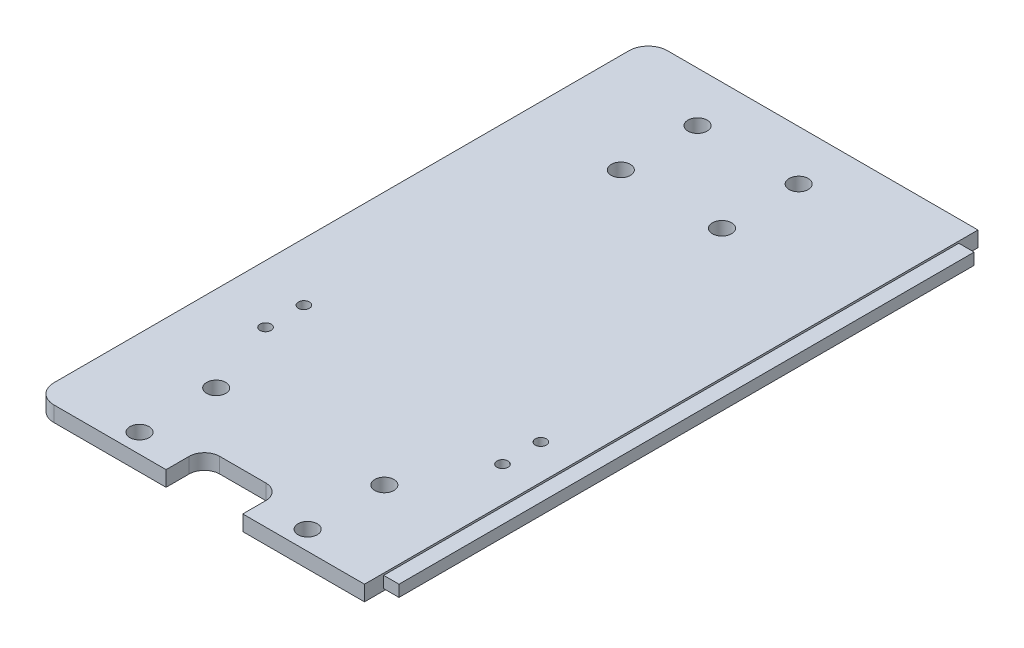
SolidWorks part; units mm, degrees
other "Markup1"
sketch "Sketch18" plane through (-127, 2.54, 10.16) normal (0, 1, 0) x (1, 0, 0)
sketch "Sketch20" plane through (-127, 2.54, 10.16) normal (0, 1, 0) x (1, 0, 0)
sketch "Sketch21" plane through (-127, 2.54, 10.16) normal (0, 1, 0) x (1, 0, 0)
sketch "Sketch22" plane through (-127, 2.54, 10.16) normal (0, 1, 0) x (1, 0, 0)
sketch "Sketch23" plane through (-127, 2.54, 10.16) normal (0, 1, 0) x (1, 0, 0)
sketch "Sketch24" plane through (-127, 2.54, 10.16) normal (0, 1, 0) x (1, 0, 0)
sketch "Sketch25" plane through (-127, 2.54, 10.16) normal (0, 1, 0) x (1, 0, 0)
sketch "Sketch27" plane through (-127, 2.54, 0) normal (0, 1, 0) x (1, 0, 0)
sketch "Sketch29" plane through (-127, 2.54, 0) normal (0, 1, 0) x (1, 0, 0)
sketch "Sketch30" plane through (-127, 2.54, 0) normal (0, 1, 0) x (1, 0, 0)
sketch "Sketch46" plane through (0, 12.7, -5.842) normal (0, 1, 0) x (1, 0, 0)
sketch "Sketch49" plane through (0, 2.54, 0) normal (0, 1, 0) x (1, 0, 0)
ref_plane "Front Plane" through (0, 0, 0) normal (0, 0, 1) x (1, 0, 0)
ref_plane "Top Plane" through (0, 0, 0) normal (0, 1, 0) x (1, 0, 0)
ref_plane "Right Plane" through (0, 0, 0) normal (1, 0, 0) x (0, 0, -1)
sketch "Sketch1" plane through (0, 0, 0) normal (0, 0, 1) x (1, 0, 0)
  line L6 (127, 2.54) -> (-127, 2.54)
  line L24 (127, 2.54) -> (127, -2.54)
  line L25 (127, -2.54) -> (-127, -2.54)
  line L26 (-127, 2.54) -> (-127, -2.54)
  line L27 (127, 2.54) -> (-127, -2.54) construction
  line L28 (127, -2.54) -> (-127, 2.54) construction
  point P0 (0, 0)
  point P1 (0, 0)
  dimension "D1" = 5.08
  dimension "D2" = 254
extrude "Boss-Extrude1" add sketch "Sketch1" along normal blind 203.2
sketch "Sketch2" plane through (0, 2.54, 0) normal (0, 1, 0) x (1, 0, 0)
  line L0 (127, -203.2) -> (-127, -203.2) construction
  line L1 (-127, 0) -> (-101.6, 0)
  line L2 (-127, 0) -> (-127, -203.2)
  line L3 (-127, -203.2) -> (-101.6, -203.2)
  line L4 (-101.6, 0) -> (-101.6, -203.2)
  line L6 (127, 0) -> (101.6, 0)
  line L7 (127, 0) -> (127, -203.2)
  line L8 (127, -203.2) -> (101.6, -203.2)
  line L9 (101.6, 0) -> (101.6, -203.2)
  dimension "D1" = 25.4
sketch "Sketch3" plane through (0, 2.54, 0) normal (0, 1, 0) x (1, 0, 0)
  line L1 (-127, -22.86) -> (-101.6, -22.86) construction
  line L2 (-127, 0) -> (-127, -203.2) construction
  line L3 (-101.6, 0) -> (-101.6, -203.2) construction
  line L4 (-114.3, -22.86) -> (-114.3, -180.34) construction
  line L5 (0, 0) -> (0, -203.2) construction
  line L6 (127, 0) -> (-127, 0) construction
  line L7 (127, -203.2) -> (-127, -203.2) construction
  line L8 (-127, 0) -> (-101.6, 0) construction
  line L9 (101.6, -21.6084) -> (127, -21.6084) construction
  line L10 (101.6, 0) -> (101.6, -203.2) construction
  line L11 (127, 0) -> (127, -203.2) construction
  circle A0 centre (-114.3, -22.86) radius 2.1
  circle A1 centre (-114.3, -180.34) radius 2.1
  circle A2 centre (114.3, -22.86) radius 2.1
  circle A3 centre (114.3, -180.34) radius 2.1
  point P14 (-114.3, -22.86)
  point P21 (-114.3, -101.6)
  point P22 (0, -101.6)
  point P26 (114.3, -21.6084)
  dimension "D1" = 4.2
  dimension "D2" = 22.86
extrude "Cut-Extrude1" [suppressed] cut sketch "Sketch3" against normal through all
sketch "Sketch5" plane through (0, 2.54, 0) normal (0, 1, 0) x (1, 0, 0)
  circle A2 centre (97.63, -133.2) radius 1.8288
  circle A3 centre (97.63, -133.2) radius 1.8288
  circle A4 centre (97.63, -145.9) radius 1.8288
  circle A5 centre (97.63, -145.9) radius 1.8288
  circle A6 centre (-19.21, -133.2) radius 1.8288
  circle A7 centre (-19.21, -133.2) radius 1.8288
  circle A8 centre (-19.21, -145.9) radius 1.8288
  circle A9 centre (-19.21, -145.9) radius 1.8288
  circle A13 centre (-97.696, -133.2) radius 1.8288
  circle A14 centre (-97.696, -145.9) radius 1.8288
  circle A15 centre (19.144, -133.2) radius 1.8288
  circle A16 centre (19.144, -145.9) radius 1.8288
  dimension "D5" = 78.486
  dimension "D6" = 78.486
  dimension "D1" = 0
  dimension "D2" = 0
  dimension "D3" = 0
  dimension "D4" = 0
extrude "Cut-Extrude2" cut sketch "Sketch5" against normal blind 152.4
sketch "Sketch7" [suppressed] plane through (0, -2.54, 0) normal (0, -1, 0) x (1, 0, 0)
  line L1 (-127, 203.2) -> (-101.6, 203.2)
  line L2 (-127, 203.2) -> (-127, 0)
  line L3 (-127, 0) -> (-101.6, 0)
  line L4 (-101.6, 203.2) -> (-101.6, 0)
  line L5 (127, 203.2) -> (101.6, 203.2)
  line L6 (127, 203.2) -> (127, 0)
  line L7 (127, 0) -> (101.6, 0)
  line L8 (101.6, 203.2) -> (101.6, 0)
  circle A0 centre (-114.3, 180.34) radius 6.35
  circle A1 centre (-114.3, 22.86) radius 6.35
  circle A2 centre (114.3, 22.86) radius 6.35
  circle A3 centre (114.3, 180.34) radius 6.35
  dimension "D1" = 12.7
extrude "Boss-Extrude2" [suppressed] add sketch "Sketch7" along normal blind 7.62
sketch "Sketch8" [suppressed] plane through (0, 2.54, 0) normal (0, 1, 0) x (1, 0, 0)
  circle A0 centre (-89.6874, -180.34) radius 3.175
  circle A1 centre (-89.6874, -154.94) radius 3.175
  point P3 (-114.3, -180.34)
  dimension "D1" = 6.35
  dimension "D2" = 24.6126
  dimension "D3" = 25.4
sketch "Sketch9" plane through (0, 2.54, 0) normal (0, 1, 0) x (1, 0, 0)
  line L0 (127, 0) -> (-127, 0) construction
  line L1 (-91.63, 0) -> (-83.63, 0)
  line L2 (-91.63, 0) -> (-91.63, -12.7)
  line L3 (-91.63, -12.7) -> (-83.63, -12.7)
  line L4 (-83.63, 0) -> (-83.63, -12.7)
  line L5 (-87.63, 0) -> (-87.63, -55.7623) construction
  line L6 (-127, -203.2) -> (-127, 0) construction
  line L7 (-61.405, -25.4) -> (-61.405, -12.7) construction
  circle A0 centre (-61.405, -12.7) radius 3.175
  circle A1 centre (-61.405, -25.4) radius 3.175
  dimension "D1" = 6.35
  dimension "D2" = 6.35
  dimension "D3" = 39.37
  dimension "D4" = 12.7
  dimension "D5" = 12.7
  dimension "D6" = 8
  dimension "D7" = 22.225
  dimension "D8" = 4
  dimension "D9" = 12.7
sketch "Sketch12" plane through (0, 2.54, 0) normal (0, 1, 0) x (1, 0, 0)
  line L0 (-91.7385, -29.21) -> (-40.9385, -29.21) construction
  line L1 (-127, -203.2) -> (-127, 0) construction
  line L2 (-66.3384, -41.91) -> (-66.3384, -16.51) construction
  line L4 (127, 0) -> (-127, 0) construction
  circle A0 centre (-91.7385, -29.21) radius 3.175
  circle A1 centre (-40.9385, -29.21) radius 3.175
  circle A2 centre (-66.3384, -16.51) radius 3.175
  circle A3 centre (-66.3384, -41.91) radius 3.175
  point P8 (-66.3385, -29.21)
  point P11 (-66.3385, -29.21)
  dimension "D1" = 6.35
  dimension "D2" = 50.8
  dimension "D3" = 29.21
  dimension "D4" = 25.4
  dimension "D5" = 60.6615
extrude "Cut-Extrude7" cut sketch "Sketch12" against normal through all
sketch "Sketch14" plane through (0, 2.54, 0) normal (0, 1, 0) x (1, 0, 0)
  line L0 (127, 0) -> (-127, 0) construction
  line L1 (-127, -203.2) -> (-127, 0) construction
  circle A0 centre (-32.8328, -16.51) radius 3.175
  circle A1 centre (-32.8328, -41.91) radius 3.175
  dimension "D1" = 6.35
  dimension "D4" = 94.1672
  dimension "D2" = 25.4
  dimension "D3" = 16.51
extrude "Cut-Extrude8" cut sketch "Sketch14" against normal up to next
mirror "Mirror1" about plane through (0, 0, 0) normal (1, 0, 0) of "Cut-Extrude8", "Cut-Extrude7"
sketch "Sketch15" plane through (0, 2.54, 0) normal (0, 1, 0) x (1, 0, 0)
  line L0 (127, -203.2) -> (127, 0) construction
  line L1 (-127, 0) -> (127, 0)
  line L2 (-127, 0) -> (-127, -10.16)
  line L3 (-127, -10.16) -> (127, -10.16)
  line L4 (127, 0) -> (127, -10.16)
  dimension "D1" = 10.16
extrude "Cut-Extrude9" [suppressed] cut sketch "Sketch15" against normal up to next
sketch "Sketch16" plane through (0, 2.54, 0) normal (0, 1, 0) x (1, 0, 0)
  line L0 (127, -203.2) -> (127, 0) construction
  line L1 (127, -203.2) -> (-127, -203.2) construction
  circle A0 centre (84.0486, -196.85) radius 3.175
  circle A1 centre (84.0486, -171.45) radius 3.175
  dimension "D2" = 6.35
  dimension "D1" = 42.9514
  dimension "D3" = 25.4
  dimension "D4" = 6.35
extrude "Cut-Extrude10" cut sketch "Sketch16" against normal through all
mirror "Mirror2" about plane through (0, 0, 0) normal (1, 0, 0) of "Cut-Extrude10"
sketch "Sketch17" plane through (0, 2.54, 0) normal (0, 1, 0) x (1, 0, 0)
  line L0 (-97.696, -133.2) -> (-19.21, -133.2) construction
  line L1 (-58.453, -133.2) -> (-58.453, -151.0054) construction
  point P6 (-19.21, -133.2)
ref_plane "Plane1" through (-58.453, 0, 0) normal (-1, 0, 0) x (0, 0, 1)
sketch "Sketch19" plane through (0, 2.54, 0) normal (0, 1, 0) x (1, 0, 0)
  line L0 (-84.0486, -171.45) -> (-28.3574, -171.45) construction
  line L1 (-84.0486, -196.85) -> (-28.3574, -196.85) construction
  line L2 (-84.0486, -182.2625) -> (-58.453, -182.2625) construction
  line L3 (-58.453, 111.76) -> (-58.453, -111.76) construction
  line L4 (-58.453, -182.2625) -> (-32.8574, -182.2625) construction
  circle A0 centre (-28.3574, -171.45) radius 3.175
  circle A1 centre (-28.3574, -196.85) radius 3.175
  circle A2 centre (-84.0486, -171.45) radius 3.175 construction
  dimension "D1" = 4.5
extrude "Cut-Extrude11" cut sketch "Sketch19" against normal up to next
mirror "Mirror3" about plane through (0, 0, 0) normal (1, 0, 0) of "Cut-Extrude11"
sketch "Sketch26" plane through (0, 2.54, 0) normal (0, 1, 0) x (1, 0, 0)
  line L1 (-98.2063, -23.913) -> (-35.7027, -23.913)
  line L2 (-98.2063, -23.913) -> (-98.2063, -34.7388)
  line L3 (-98.2063, -34.7388) -> (-35.7027, -34.7388)
  line L4 (-35.7027, -23.913) -> (-35.7027, -34.7388)
  line L5 (31.7031, -23.913) -> (98.7003, -23.913)
  line L6 (31.7031, -23.913) -> (31.7031, -34.7388)
  line L7 (31.7031, -34.7388) -> (98.7003, -34.7388)
  line L8 (98.7003, -23.913) -> (98.7003, -34.7388)
extrude "Boss-Extrude3" add sketch "Sketch26" against normal up to surface (5.08 mm away)
sketch "Sketch28" plane through (0, 2.54, 0) normal (0, 1, 0) x (1, 0, 0)
  line L0 (127, -203.2) -> (-127, -203.2) construction
  line L1 (-68.903, -203.2) -> (-43.503, -203.2)
  line L2 (-68.903, -203.2) -> (-68.903, -190.5)
  line L3 (-68.903, -190.5) -> (-43.503, -190.5)
  line L4 (-43.503, -203.2) -> (-43.503, -190.5)
  line L5 (-84.0486, -171.45) -> (-28.3574, -171.45) construction
  line L6 (43.503, -203.2) -> (68.903, -203.2)
  line L7 (43.503, -203.2) -> (43.503, -190.5)
  line L8 (43.503, -190.5) -> (68.903, -190.5)
  line L9 (68.903, -203.2) -> (68.903, -190.5)
  line L10 (28.3574, -171.45) -> (84.0486, -171.45) construction
  point P18 (-56.203, -190.5)
  point P19 (-56.203, -171.45)
  point P20 (56.203, -190.5)
  point P21 (56.203, -171.45)
  dimension "D1" = 25.4
  dimension "D2" = 12.7
extrude "Cut-Extrude12" cut sketch "Sketch28" against normal up to next
sketch "Sketch31" plane through (0, 2.54, 0) normal (0, 1, 0) x (1, 0, 0)
  line L0 (-127, 0) -> (127, 0) construction
  line L2 (-127, -203.2) -> (0, -203.2)
  line L3 (-127, -203.2) -> (-127, 0)
  line L4 (-127, 0) -> (0, 0)
  line L5 (0, -203.2) -> (0, 0)
extrude "Cut-Extrude14" cut sketch "Sketch31" against normal up to next
sketch "Sketch34" plane through (0, 2.54, 0) normal (0, 1, 0) x (1, 0, 0)
  line L1 (127, 0) -> (114.3, 0)
  line L2 (127, 0) -> (127, 152.4)
  line L3 (127, 152.4) -> (114.3, 152.4)
  line L4 (114.3, 0) -> (114.3, 152.4)
  dimension "D1" = 12.7
  dimension "D2" = 152.4
extrude "Boss-Extrude5" add sketch "Sketch34" against normal up to surface (5.08 mm away)
sketch "Sketch35" plane through (0, -2.54, 0) normal (0, -1, 0) x (1, 0, 0)
  line L0 (93.7489, 203.2) -> (93.7489, -151.0184)
  line L1 (68.903, 203.2) -> (127, 203.2) construction
  line L2 (127, 203.2) -> (127, -152.4) construction
  line L3 (127, -38.1) -> (93.7489, -38.1)
  line L4 (0, 0) -> (114.3, 0) construction
  dimension "D1" = 33.2511
  dimension "D2" = 38.1
sketch "Sketch36" plane through (114.3, 0, 0) normal (-1, 0, 0) x (0, 0, 1)
  line L0 (-38.1, -2.54) -> (-38.1, 2.54) construction
  line L1 (203.2, -2.54) -> (-151.0184, -2.54) construction
  line L2 (-152.4, 2.54) -> (0, 2.54) construction
  line L4 (-12.7, -25.4) -> (-63.5, -25.4)
  line L5 (-12.7, -25.4) -> (-12.7, 25.4)
  line L6 (-12.7, 25.4) -> (-63.5, 25.4)
  line L7 (-63.5, -25.4) -> (-63.5, 25.4)
  line L8 (-12.7, -25.4) -> (-63.5, 25.4) construction
  line L9 (-12.7, 25.4) -> (-63.5, -25.4) construction
  point P8 (-38.1, 0)
  dimension "D1" = 50.8
extrude "Boss-Extrude6" add sketch "Sketch36" against normal up to surface (12.7 mm away)
sketch "Sketch37" plane through (114.3, 0, 0) normal (-1, 0, 0) x (0, 0, 1)
  line L0 (-12.7, 25.4) -> (-63.5, 25.4) construction
  circle A0 centre (-38.1, 0) radius 4
  point P4 (-38.1, 25.4)
  dimension "D1" = 8
extrude "Cut-Extrude15" cut sketch "Sketch37" against normal up to next
sketch "Sketch38" plane through (0, -2.54, 0) normal (0, -1, 0) x (1, 0, 0)
  line L0 (127, -63.5) -> (114.3, -63.5) construction
  line L1 (102.4579, -63.5) -> (162.4454, -63.5)
  line L2 (102.4579, -63.5) -> (102.4579, -165.9179)
  line L3 (102.4579, -165.9179) -> (162.4454, -165.9179)
  line L4 (162.4454, -63.5) -> (162.4454, -165.9179)
extrude "Cut-Extrude16" cut sketch "Sketch38" against normal up to next
sketch "Sketch39" plane through (114.3, 0, 0) normal (-1, 0, 0) x (0, 0, 1)
  line L1 (-12.7, -25.4) -> (-63.5, -25.4)
  line L2 (-12.7, -25.4) -> (-12.7, 25.4)
  line L3 (-12.7, 25.4) -> (-63.5, 25.4)
  line L4 (-63.5, -25.4) -> (-63.5, 25.4)
  line L5 (-12.7, -25.4) -> (-63.5, 25.4) construction
  line L6 (-12.7, 25.4) -> (-63.5, -25.4) construction
  circle A0 centre (-38.1, 0) radius 4 construction
  circle A1 centre (-38.1, 0) radius 4
  point P0 (-38.1, 0)
extrude "Boss-Extrude7" add sketch "Sketch39" along normal up to vertex
sketch "Sketch40" plane through (93.7489, 0, 0) normal (-1, 0, 0) x (0, 0, 1)
  line L1 (-12.7, -25.4) -> (-63.5, -25.4)
  line L2 (-12.7, -25.4) -> (-12.7, 25.4)
  line L3 (-12.7, 25.4) -> (-63.5, 25.4)
  line L4 (-63.5, -25.4) -> (-63.5, 25.4)
  line L5 (-12.7, -25.4) -> (-63.5, 25.4) construction
  line L6 (-12.7, 25.4) -> (-63.5, -25.4) construction
  circle A0 centre (-38.1, 0) radius 8.255
  circle A1 centre (-38.1, 0) radius 4 construction
  dimension "D1" = 16.51
extrude "Cut-Extrude17" cut sketch "Sketch40" against normal blind 2.54
sketch "Sketch41" plane through (0, 0, 0) normal (0, 0, -1) x (-1, 0, 0)
  line L0 (-127, -2.54) -> (-93.7489, -2.54) construction
  line L1 (-114.3, -2.54) -> (-96.2889, -2.54)
  line L2 (-114.3, -2.54) -> (-114.3, 2.54)
  line L3 (-114.3, 2.54) -> (-96.2889, 2.54)
  line L4 (-96.2889, -2.54) -> (-96.2889, 2.54)
  line L5 (-114.3, 2.54) -> (0, 2.54) construction
  line L6 (-96.2889, -25.4) -> (-96.2889, 25.4) construction
  line L7 (-114.3, -2.54) -> (-114.3, 2.54) construction
extrude "Boss-Extrude8" add sketch "Sketch41" along normal up to surface (12.7 mm away)
sketch "Sketch42" plane through (0, 0, -12.7) normal (0, 0, 1) x (1, 0, 0)
  line L6 (79.901, 2.54) -> (79.901, -2.54) construction
  line L7 (127, 2.54) -> (68.903, 2.54) construction
  line L8 (68.903, -2.54) -> (127, -2.54) construction
  line L9 (127, 25.4) -> (127, 2.54) construction
  line L10 (127, 12.7) -> (119.38, 12.7)
  line L11 (127, 12.7) -> (127, 2.54)
  line L12 (127, 2.54) -> (119.38, 2.54)
  line L13 (119.38, 12.7) -> (119.38, 2.54)
  line L15 (127, 2.54) -> (96.2889, 2.54) construction
  dimension "D1" = 10.16
  dimension "D2" = 7.62
extrude "Boss-Extrude9" add sketch "Sketch42" along normal up to surface (215.9 mm away)
ref_plane "Plane2" through (0, 0, 0) normal (0, -1, 0) x (-1, 0, 0)
mirror "Mirror4" about plane through (0, 0, 0) normal (0, -1, 0) of "Boss-Extrude9"
fillet "Fillet2" radius 12.7 1 edges at (96.2889, 0, 0)
fillet "Fillet3" radius 10.16 4 edges at (119.38, 2.54, 95.25) (119.38, -2.54, 95.25) (119.38, 7.62, -12.7) (119.38, -7.62, -12.7)
fillet "Fillet4" radius 6.35 12 edges at (96.2889, -25.4, -38.1) (96.2889, 0, -63.5) (96.2889, 25.4, -38.1) (96.2889, 13.97, -12.7) (96.2889, -13.97, -12.7) (96.2889, 0, -29.845) (0, 0, 203.2) (0, 0, 0) (111.6444, 25.4, -12.7) (111.6444, 25.4, -63.5) (111.6444, -25.4, -63.5) (111.6444, -25.4, -12.7)
fillet "Fillet5" radius 5.08 2 edges at (68.903, 0, 190.5) (43.503, 0, 190.5)
sketch "Sketch43" plane through (127, 0, 0) normal (1, 0, 0) x (0, 0, -1)
  circle A0 centre (38.1, 0) radius 9.525
  circle A1 centre (38.1, 0) radius 4 construction
  dimension "D1" = 19.05
extrude "Cut-Extrude18" cut sketch "Sketch43" against normal blind 10.16
sketch "Sketch44" plane through (0, 2.54, 0) normal (0, 1, 0) x (1, 0, 0)
  line L0 (83.5889, 0) -> (6.35, 0) construction
  line L1 (-62.3754, 89.2362) -> (191.0738, 89.2362)
  line L2 (-62.3754, 89.2362) -> (-62.3754, 0)
  line L3 (-62.3754, 0) -> (191.0738, 0)
  line L4 (191.0738, 89.2362) -> (191.0738, 0)
extrude "Cut-Extrude19" cut sketch "Sketch44" against normal through all both and the other way through all
sketch "Sketch45" plane through (0, 0, 0) normal (0, 0, -1) x (-1, 0, 0)
  line L1 (-127, 2.9845) -> (-121.031, 2.9845)
  line L2 (-127, 2.9845) -> (-127, -2.9845)
  line L3 (-127, -2.9845) -> (-121.031, -2.9845)
  line L4 (-121.031, 2.9845) -> (-121.031, -2.9845)
  line L5 (-127, 2.9845) -> (-121.031, -2.9845) construction
  line L6 (-127, -2.9845) -> (-121.031, 2.9845) construction
  line L7 (-127, -12.7) -> (-127, 12.7) construction
  point P0 (-124.0155, 0)
  point P9 (-127, 0)
  dimension "D1" = 5.969
extrude "Boss-Extrude10" add sketch "Sketch45" along normal blind 5.842
sketch "Sketch47" plane through (0, -2.54, 0) normal (0, -1, 0) x (1, 0, 0)
  line L1 (109.22, 0) -> (162.4631, 0)
  line L2 (109.22, 0) -> (109.22, 207.8505)
  line L3 (109.22, 207.8505) -> (162.4631, 207.8505)
  line L4 (162.4631, 0) -> (162.4631, 207.8505)
extrude "Cut-Extrude20" cut sketch "Sketch47" against normal through all both and the other way through all
sketch "Sketch48" plane through (109.22, 0, 0) normal (1, 0, 0) x (0, 0, -1)
  line L0 (-60.071, 0) -> (60.071, 0) construction
  line L1 (-196.85, -1.905) -> (-6.35, -1.905)
  line L2 (-196.85, -1.905) -> (-196.85, 1.905)
  line L3 (-196.85, 1.905) -> (-6.35, 1.905)
  line L4 (-6.35, -1.905) -> (-6.35, 1.905)
  line L5 (-196.85, -1.905) -> (-6.35, 1.905) construction
  line L6 (-196.85, 1.905) -> (-6.35, -1.905) construction
  line L9 (0, 2.54) -> (0, -2.54) construction
  line L10 (-203.2, -2.54) -> (-203.2, 2.54) construction
  point P0 (-101.6, 0)
  dimension "D1" = 3.81
  dimension "D2" = 6.35
  dimension "D3" = 6.35
extrude "Boss-Extrude11" add sketch "Sketch48" along normal blind 5.08
sketch "Sketch32" plane through (0, 2.54, 0) normal (0, 1, 0) x (1, 0, 0)
  line L1 (0, 0) -> (6.35, 0)
  line L2 (0, 0) -> (0, -25.4)
  line L3 (0, -25.4) -> (6.35, -25.4)
  line L4 (6.35, 0) -> (6.35, -25.4)
  dimension "D1" = 25.4
  dimension "D2" = 6.35
extrude "Boss-Extrude4" add sketch "Sketch32" along normal blind 25.4
